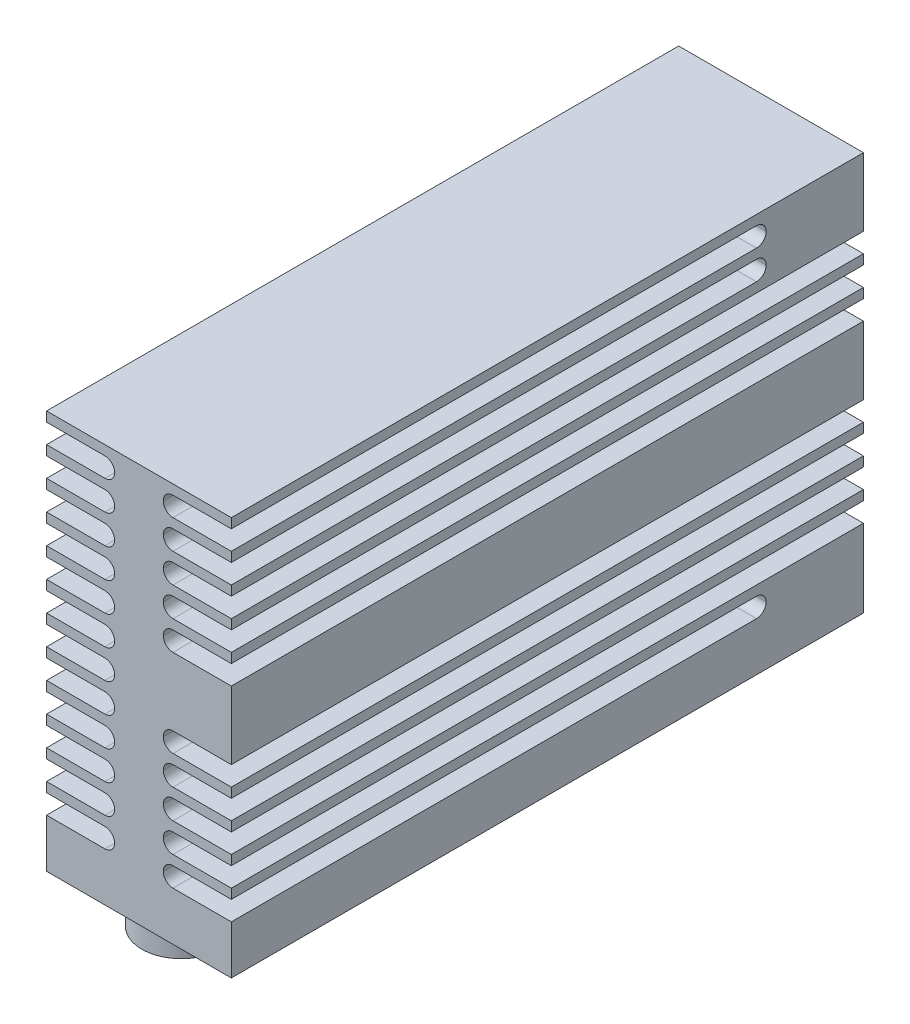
SolidWorks part; units mm, degrees
ref_plane "Front Plane" through (0, 0, 0) normal (0, 0, 1) x (1, 0, 0)
ref_plane "Top Plane" through (0, 0, 0) normal (0, 1, 0) x (1, 0, 0)
ref_plane "Right Plane" through (0, 0, 0) normal (1, 0, 0) x (0, 0, -1)
sketch "Sketch1" plane through (0, 0, 0) normal (0, 0, 1) x (1, 0, 0)
  line L1 (0, 0) -> (19, 0)
  line L2 (0, 0) -> (0, 45)
  line L3 (0, 45) -> (19, 45)
  line L4 (19, 0) -> (19, 45)
  dimension "D1" = 45
  dimension "D2" = 19
extrude "Boss-Extrude1" add sketch "Sketch1" along normal blind 65
sketch "Sketch3" plane through (0, 0, 65) normal (0, 0, 1) x (1, 0, 0)
  line L0 (0, 45) -> (0, 0) construction
  line L1 (0, 0) -> (7, 0) construction
  line L2 (0, 0) -> (0, 32) construction
  line L3 (0, 32) -> (7, 32) construction
  line L4 (7, 0) -> (7, 32) construction
  line L5 (0, 44) -> (7, 44)
  line L6 (0, 44) -> (0, 42)
  line L7 (0, 42) -> (7, 42)
  line L8 (7, 44) -> (7, 42)
  line L9 (19, 45) -> (0, 45) construction
  line L10 (0, 41) -> (7, 41)
  line L11 (0, 41) -> (0, 39)
  line L12 (0, 39) -> (7, 39)
  line L13 (7, 41) -> (7, 39)
  line L14 (0, 38) -> (7, 38)
  line L15 (0, 38) -> (0, 36)
  line L16 (0, 36) -> (7, 36)
  line L17 (7, 38) -> (7, 36)
  line L18 (0, 35) -> (7, 35)
  line L19 (0, 35) -> (0, 33)
  line L20 (0, 33) -> (7, 33)
  line L21 (7, 35) -> (7, 33)
  line L22 (0, 32) -> (7, 32)
  line L23 (0, 32) -> (0, 30)
  line L24 (0, 30) -> (7, 30)
  line L25 (7, 32) -> (7, 30)
  line L26 (0, 29) -> (7, 29)
  line L27 (0, 29) -> (0, 27)
  line L28 (0, 27) -> (7, 27)
  line L29 (7, 29) -> (7, 27)
  line L30 (0, 26) -> (7, 26)
  line L31 (0, 26) -> (0, 24)
  line L32 (0, 24) -> (7, 24)
  line L33 (7, 26) -> (7, 24)
  line L34 (0, 23) -> (7, 23)
  line L35 (0, 23) -> (0, 21)
  line L36 (0, 21) -> (7, 21)
  line L37 (7, 23) -> (7, 21)
  line L38 (0, 20) -> (7, 20)
  line L39 (0, 20) -> (0, 18)
  line L40 (0, 18) -> (7, 18)
  line L41 (7, 20) -> (7, 18)
  line L42 (0, 17) -> (7, 17)
  line L43 (0, 17) -> (0, 15)
  line L44 (0, 15) -> (7, 15)
  line L45 (7, 17) -> (7, 15)
  line L46 (0, 14) -> (7, 14)
  line L47 (0, 14) -> (0, 12)
  line L48 (0, 12) -> (7, 12)
  line L49 (7, 14) -> (7, 12)
  line L50 (0, 11) -> (7, 11)
  line L51 (0, 11) -> (0, 9)
  line L52 (0, 9) -> (7, 9)
  line L53 (7, 11) -> (7, 9)
  line L54 (9.5, 45) -> (9.5, 0) construction
  line L55 (19, 45) -> (0, 45) construction
  line L56 (0, 0) -> (19, 0) construction
  line L58 (12, 11) -> (12, 9)
  line L59 (19, 9) -> (12, 9)
  line L60 (19, 11) -> (19, 9)
  line L61 (19, 11) -> (12, 11)
  line L62 (12, 14) -> (12, 12)
  line L63 (19, 12) -> (12, 12)
  line L64 (19, 14) -> (19, 12)
  line L65 (19, 14) -> (12, 14)
  line L66 (12, 17) -> (12, 15)
  line L67 (19, 15) -> (12, 15)
  line L68 (19, 17) -> (19, 15)
  line L69 (19, 17) -> (12, 17)
  line L70 (12, 20) -> (12, 18)
  line L71 (19, 18) -> (12, 18)
  line L72 (19, 20) -> (19, 18)
  line L73 (19, 20) -> (12, 20)
  line L74 (12, 23) -> (12, 21)
  line L75 (19, 21) -> (12, 21)
  line L76 (19, 23) -> (19, 21)
  line L77 (19, 23) -> (12, 23)
  line L78 (12, 26) -> (12, 24) construction
  line L79 (19, 24) -> (12, 24) construction
  line L80 (19, 26) -> (19, 24) construction
  line L81 (19, 26) -> (12, 26) construction
  line L82 (12, 29) -> (12, 27) construction
  line L83 (19, 27) -> (12, 27) construction
  line L84 (19, 29) -> (19, 27) construction
  line L85 (19, 29) -> (12, 29) construction
  line L86 (12, 32) -> (12, 30)
  line L87 (19, 30) -> (12, 30)
  line L88 (19, 32) -> (19, 30)
  line L89 (19, 32) -> (12, 32)
  line L90 (12, 35) -> (12, 33)
  line L91 (19, 33) -> (12, 33)
  line L92 (19, 35) -> (19, 33)
  line L93 (19, 35) -> (12, 35)
  line L94 (12, 38) -> (12, 36)
  line L95 (19, 36) -> (12, 36)
  line L96 (19, 38) -> (19, 36)
  line L97 (19, 38) -> (12, 38)
  line L98 (12, 41) -> (12, 39)
  line L99 (19, 39) -> (12, 39)
  line L100 (19, 41) -> (19, 39)
  line L101 (19, 41) -> (12, 41)
  line L102 (12, 44) -> (12, 42)
  line L103 (19, 42) -> (12, 42)
  line L104 (19, 44) -> (19, 42)
  line L105 (19, 44) -> (12, 44)
  line L113 (0, 8) -> (7, 8)
  line L114 (0, 8) -> (0, 6)
  line L115 (0, 6) -> (7, 6)
  line L116 (7, 8) -> (7, 6)
  dimension "D1" = 7
  dimension "D2" = 13
  dimension "D3" = 2
  dimension "D4" = 1
  dimension "D5" = 13
extrude "Cut-Extrude1" cut sketch "Sketch3" against normal up to next
sketch "Sketch4" plane through (0, 0, 0) normal (0, 0, -1) x (-1, 0, 0)
  line L0 (0, 0) -> (0, 32) construction
  line L1 (0, 0) -> (-7, 0) construction
  line L2 (-7, 0) -> (-7, 32) construction
  line L3 (0, 32) -> (-7, 32) construction
  line L4 (0, 0) -> (0, 32)
  line L5 (0, 0) -> (-7, 0)
  line L6 (-7, 0) -> (-7, 32)
  line L7 (0, 32) -> (-7, 32)
extrude "Cut-Extrude2" cut sketch "Sketch4" against normal blind 52
sketch "Sketch5" plane through (0, 0, 0) normal (0, -1, 0) x (1, 0, 0)
  circle A0 centre (7.8375, 58.98) radius 2.1971 construction
  circle A1 centre (7.8375, 58.98) radius 2.1971
sketch "Sketch6" plane through (12, 0, 0) normal (1, 0, 0) x (0, 0, -1)
  line L0 (0, 44) -> (-65, 44) construction
  line L1 (0, 42) -> (-10, 42)
  line L2 (0, 42) -> (0, 44)
  line L3 (0, 44) -> (-10, 44)
  line L4 (-10, 42) -> (-10, 44)
  line L5 (0, 39) -> (-65, 39) construction
  line L6 (0, 41) -> (-10, 41)
  line L7 (0, 41) -> (0, 39)
  line L8 (0, 39) -> (-10, 39)
  line L9 (-10, 41) -> (-10, 39)
  line L10 (0, 11) -> (-65, 11) construction
  line L11 (0, 9) -> (-10, 9)
  line L12 (0, 9) -> (0, 11)
  line L13 (0, 11) -> (-10, 11)
  line L14 (-10, 9) -> (-10, 11)
  dimension "D1" = 10
extrude "Boss-Extrude2" add sketch "Sketch6" along normal up to surface (7 mm away)
sketch "Sketch7" plane through (7, 0, 0) normal (-1, 0, 0) x (0, 0, 1)
  line L34 (65, 11) -> (52, 11)
  line L35 (52, 11) -> (52, 12)
  line L36 (52, 12) -> (65, 12)
  line L37 (65, 12) -> (65, 14)
  line L38 (65, 14) -> (52, 14)
  line L39 (52, 14) -> (52, 15)
  line L40 (52, 15) -> (65, 15)
  line L41 (65, 15) -> (65, 17)
  line L42 (65, 17) -> (52, 17)
  line L43 (52, 17) -> (52, 18)
  line L44 (52, 18) -> (65, 18)
  line L45 (65, 18) -> (65, 20)
  line L46 (65, 20) -> (52, 20)
  line L47 (52, 20) -> (52, 21)
  line L48 (52, 21) -> (65, 21)
  line L49 (65, 21) -> (65, 23)
  line L50 (65, 23) -> (52, 23)
  line L51 (52, 23) -> (52, 24)
  line L52 (52, 24) -> (65, 24)
  line L53 (65, 24) -> (65, 26)
  line L54 (65, 26) -> (52, 26)
  line L55 (52, 26) -> (52, 27)
  line L56 (52, 27) -> (65, 27)
  line L57 (65, 27) -> (65, 29)
  line L58 (65, 29) -> (52, 29)
  line L59 (52, 29) -> (52, 30)
  line L60 (52, 30) -> (65, 30)
  line L61 (65, 30) -> (65, 32)
  line L62 (65, 32) -> (0, 32)
  line L63 (0, 32) -> (0, 0)
  line L64 (0, 0) -> (52, 0)
  line L65 (52, 0) -> (52, 9)
  line L66 (52, 9) -> (65, 9)
  line L67 (65, 9) -> (65, 11)
  line L68 (65, 11) -> (52, 11)
  line L69 (52, 11) -> (52, 12)
  line L70 (52, 12) -> (65, 12)
  line L71 (65, 12) -> (65, 14)
  line L72 (65, 14) -> (52, 14)
  line L73 (52, 14) -> (52, 15)
  line L74 (52, 15) -> (65, 15)
  line L75 (65, 15) -> (65, 17)
  line L76 (65, 17) -> (52, 17)
  line L77 (52, 17) -> (52, 18)
  line L78 (52, 18) -> (65, 18)
  line L79 (65, 18) -> (65, 20)
  line L80 (65, 20) -> (52, 20)
  line L81 (52, 20) -> (52, 21)
  line L82 (52, 21) -> (65, 21)
  line L83 (65, 21) -> (65, 23)
  line L84 (65, 23) -> (52, 23)
  line L85 (52, 23) -> (52, 24)
  line L86 (52, 24) -> (65, 24)
  line L87 (65, 24) -> (65, 26)
  line L88 (65, 26) -> (52, 26)
  line L89 (52, 26) -> (52, 27)
  line L90 (52, 27) -> (65, 27)
  line L91 (65, 27) -> (65, 29)
  line L92 (65, 29) -> (52, 29)
  line L93 (52, 29) -> (52, 30)
  line L94 (52, 30) -> (65, 30)
  line L95 (65, 30) -> (65, 32)
  line L96 (65, 32) -> (0, 32)
  line L97 (0, 32) -> (0, 0)
  line L98 (0, 0) -> (52, 0)
  line L99 (52, 0) -> (52, 9)
  line L100 (52, 9) -> (65, 9)
  line L101 (65, 9) -> (65, 11)
  circle A0 centre (45.05, 26.8729) radius 2.1 construction
  circle A1 centre (32.35, 26.8729) radius 2.1 construction
  circle A2 centre (19.65, 26.8729) radius 2.1 construction
  circle A3 centre (45.05, 26.8729) radius 2.1
  circle A4 centre (32.35, 26.8729) radius 2.1
  circle A5 centre (19.65, 26.8729) radius 2.1
  circle A6 centre (6.95, 26.8729) radius 2.1 construction
  circle A7 centre (6.95, 26.8729) radius 2.1
  dimension "D1" = 0
sketch "Sketch8" plane through (0, 0, 0) normal (0, -1, 0) x (1, 0, 0)
  line L1 (7, 52) -> (19, 52)
  line L2 (7, 52) -> (7, 0)
  line L3 (7, 0) -> (19, 0)
  line L4 (19, 52) -> (19, 0)
extrude "Cut-Extrude3" cut sketch "Sketch8" against normal blind 4
sketch "Sketch9" plane through (0, 0, 0) normal (0, 0, -1) x (-1, 0, 0)
  circle A0 centre (-15, 9.4632) radius 2.159 construction
  circle A1 centre (-15, 41.4632) radius 2.159 construction
  circle A2 centre (-15, 9.4632) radius 2.159
  circle A3 centre (-15, 41.4632) radius 2.159
hole_wizard "M3x0.5 Tapped Hole1" positions "3DSketch1" profile "Sketch10" tap size "M3x0.5" standard "ANSI Metric"
sketch3d "3DSketch1"
  line L0 (7, 26.8729, 19.65) -> (7, 26.8729, 45.05) construction
  point P0 (15, 41.4632, 0)
  point P3 (15, 9.4632, 0)
  point P6 (7.8375, 0, 58.98)
  point P9 (7, 26.8729, 6.95)
  point P12 (7, 26.8729, 19.65)
  point P15 (7, 26.8729, 32.35)
  point P18 (7, 26.8729, 45.05)
  point P21 (7, 26.8729, 37.85)
  dimension "D1" = 18.2
sketch "Sketch10" plane through (15, 41.4632, 0) normal (1, 0, 0) x (0, 1, 0)
  line L0 (0, 0) -> (0, 8.7511)
  line L1 (0, 8.7511) -> (1.25, 8)
  line L2 (1.25, 8) -> (1.25, 0)
  line L5 (1.25, 0) -> (0, 0)
  line L10 (0, 8.7511) -> (-1.25, 8) construction
  line L11 (0, -6.35) -> (0, 107.95) construction
  dimension "Tap Drill Dia." = 2.5
  dimension "Tap Drill Depth" = 8
  dimension "Drill Angle" = 118
fillet "Fillet1" radius 1 50 edges at (15.5, 39, 10) (15.5, 42, 10) (15.5, 44, 10) (15.5, 41, 10) (15.5, 9, 10) (15.5, 11, 10) (7, 26, 58.5) (12, 11, 37.5) (12, 14, 32.5) (12, 17, 32.5) (12, 20, 32.5) (12, 23, 32.5) (12, 32, 32.5) (12, 35, 32.5) (12, 38, 32.5) (12, 41, 37.5) (12, 44, 37.5) (12, 42, 37.5) (12, 39, 37.5) (12, 36, 32.5) (12, 33, 32.5) (12, 30, 32.5) (12, 21, 32.5) (12, 18, 32.5) (12, 15, 32.5) (12, 12, 32.5) (12, 9, 37.5) (7, 11, 58.5) (7, 14, 58.5) (7, 17, 58.5) (7, 20, 58.5) (7, 23, 58.5) (7, 29, 58.5) (7, 9, 58.5) (7, 12, 58.5) (7, 15, 58.5) (7, 18, 58.5) (7, 21, 58.5) (7, 24, 58.5) (7, 27, 58.5) (7, 30, 58.5) (7, 41, 32.5) (7, 38, 32.5) (7, 35, 32.5) (7, 32, 32.5) (7, 33, 32.5) (7, 36, 32.5) (7, 39, 32.5) (7, 42, 32.5) (7, 44, 32.5)
sketch "Sketch11" plane through (0, 0, 0) normal (0, -1, 0) x (1, 0, 0)
  line L4 (0, 52) -> (19, 52)
  line L5 (19, 52) -> (19, 65)
  line L6 (19, 65) -> (0, 65)
  line L7 (0, 65) -> (0, 52)
  line L8 (0, 52) -> (19, 52)
  line L9 (19, 52) -> (19, 65)
  line L10 (19, 65) -> (0, 65)
  line L11 (0, 65) -> (0, 52)
  circle A0 centre (7.8375, 58.98) radius 4.064
  dimension "D2" = 8.128
  dimension "D1" = 0
extrude "Cut-Extrude4" cut sketch "Sketch11" against normal blind 4
